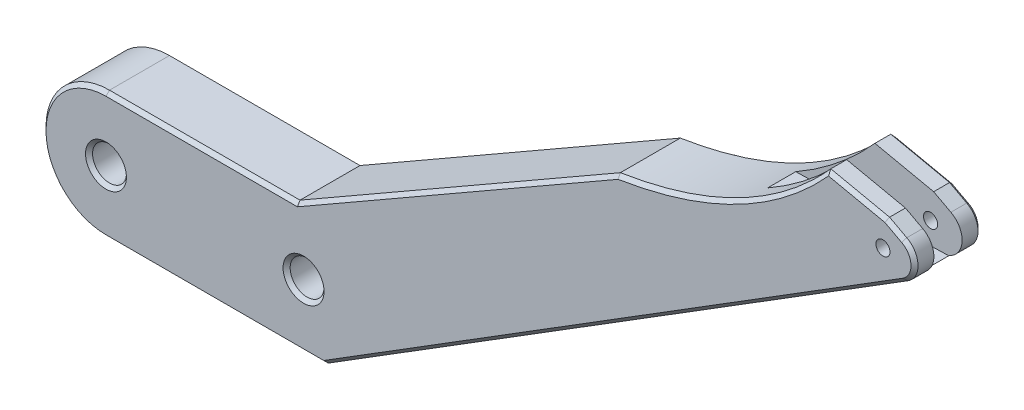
SolidWorks part; units mm, degrees
ref_plane "Front Plane" through (0, 0, 0) normal (0, 0, 1) x (1, 0, 0)
ref_plane "Top Plane" through (0, 0, 0) normal (0, 1, 0) x (1, 0, 0)
ref_plane "Right Plane" through (0, 0, 0) normal (1, 0, 0) x (0, 0, -1)
sketch "Sketch1" plane through (0, 0, 0) normal (0, 0, 1) x (1, 0, 0)
  line L14 (10, 28) -> (46, 28)
  line L15 (10, 28) -> (10, 10)
  line L16 (10, 10) -> (50, 10)
  line L29 (122.7706, 71.29) -> (136.5818, 63.9419)
  line L35 (91.3985, 54.0702) -> (46, 28)
  line L42 (136.5818, 63.9419) -> (50, 10)
  circle A1 centre (19, 19) radius 2.4
  circle A3 centre (47, 19) radius 2.4
  circle A8 centre (129.1065, 63.9419) radius 1
  spline S0 degree 2 poles (91.3985, 54.0702) (111.4775, 57.2541) (122.7706, 71.29) knots 0 0 0 1 1 1
  point P8 (10, 19)
  dimension "D1" = 4.8
  dimension "D3" = 1
  dimension "D8" = 4.8
  dimension "D13" = 75.7706
  dimension "D5" = 44.3985
  dimension "D12" = 2
  dimension "D6" = 36.6503
  dimension "D7" = 52.29
  dimension "D2" = 9
  dimension "D4" = 18
  dimension "D9" = 28
  dimension "D10" = 10
  dimension "D11" = 10
  dimension "D14" = 44.9419
  dimension "D15" = 35.0702
  dimension "D16" = 40
  dimension "D17" = 82.1065
  dimension "D18" = 44.9419
  dimension "D19" = 1.6046
  dimension "D20" = 15.6442
extrude "Boss-Extrude1" add sketch "Sketch1" along normal mid plane 9.5
fillet "Fillet1" radius 9 2 edges at (10, 10, 0) (10, 28, 0)
sketch "Sketch2" plane through (0, 0, 0) normal (0, 0, 1) x (1, 0, 0)
  line L0 (106.1468, 60.2763) -> (142.9111, 61.1645)
  line L1 (142.9111, 61.1645) -> (153.6539, 73.8992)
  line L2 (153.6539, 73.8992) -> (130.6184, 84.1447)
  line L3 (130.6184, 84.1447) -> (106.1468, 60.2763)
  line L4 (98.6553, 63.2062) -> (161.4793, 64.724) construction
  dimension "D1" = 3.11
extrude "Cut-Extrude1" cut sketch "Sketch2" against normal mid plane 4
sketch "Sketch3" plane through (0, 0, 0) normal (0, 0, 1) x (1, 0, 0)
  line L0 (114.7224, 70.8449) -> (142.2418, 64.9782)
  line L1 (142.2418, 64.9782) -> (128.5146, 79.4651)
  line L2 (128.5146, 79.4651) -> (114.7224, 70.8449)
extrude "Cut-Extrude2" cut sketch "Sketch3" against normal through all both and the other way through all
fillet "Fillet4" radius 3 2 edges at (136.5818, 63.9419, -3.375) (136.5818, 63.9419, 3.375)
chamfer "Chamfer1" distance 0.5 angle 45 24 edges at (130.7681, 67.035, -4.75) (133.5779, 63.8394, -4.75) (91.083, 35.5954, -4.75) (49.4, 19, -4.75) (34.5, 10, -4.75) (12.636, 12.636, -4.75) (12.636, 25.364, -4.75) (125.3835, 68.5721, -4.75) (68.6992, 41.0351, -4.75) (32.5, 28, -4.75) (21.4, 19, -4.75) (130.7681, 67.035, 4.75) (133.5779, 63.8394, 4.75) (91.083, 35.5954, 4.75) (49.4, 19, 4.75) (21.4, 19, 4.75) (34.5, 10, 4.75) (12.636, 12.636, 4.75) (12.636, 25.364, 4.75) (125.3835, 68.5721, 4.75) (68.6992, 41.0351, 4.75) (32.5, 28, 4.75)
